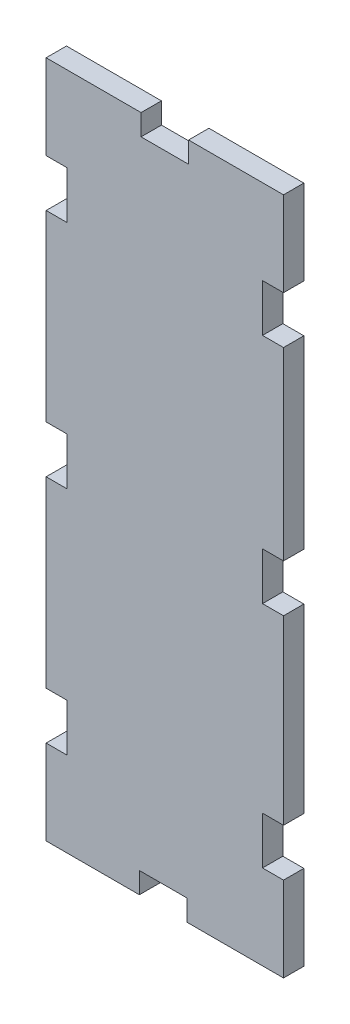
SolidWorks part; units mm, degrees
ref_plane "Front Plane" through (0, 0, 0) normal (0, 0, 1) x (1, 0, 0)
ref_plane "Top Plane" through (0, 0, 0) normal (0, 1, 0) x (1, 0, 0)
ref_plane "Right Plane" through (0, 0, 0) normal (1, 0, 0) x (0, 0, -1)
sketch "Sketch1" plane through (0, 0, 0) normal (0, 0, 1) x (1, 0, 0)
  line L1 (0, 0) -> (70, 0)
  line L2 (0, 0) -> (0, 200)
  line L3 (0, 200) -> (70, 200)
  line L4 (70, 0) -> (70, 200)
  dimension "D1" = 200
  dimension "D2" = 70
extrude "Boss-Extrude2" add sketch "Sketch1" along normal blind 6
sketch "Sketch4" plane through (0, 0, 6) normal (0, 0, 1) x (1, 0, 0)
  line L0 (0, 0) -> (70, 0) construction
  line L1 (70, 0) -> (70, 200) construction
  line L2 (70, 200) -> (0, 200) construction
  line L3 (0, 200) -> (0, 0) construction
  line B0 (28, 193.8) -> (42, 193.8)
  line B1 (42, 193.8) -> (42, 200)
  line B2 (42, 200) -> (28, 200)
  line B3 (28, 200) -> (28, 193.8)
  line B4 (27.5, 0) -> (41.5, 0)
  line B5 (41.5, 0) -> (41.5, 6.2)
  line B6 (41.5, 6.2) -> (27.5, 6.2)
  line B7 (27.5, 6.2) -> (27.5, 0)
  line B8 (6.2, 161) -> (6.2, 175)
  line B9 (6.2, 175) -> (0, 175)
  line B10 (0, 175) -> (0, 161)
  line B11 (0, 161) -> (6.2, 161)
  line B12 (0, 168) -> (6.2, 168) construction
  line B13 (6.2, 93) -> (6.2, 107)
  line B14 (6.2, 107) -> (0, 107)
  line B15 (0, 107) -> (0, 93)
  line B16 (0, 93) -> (6.2, 93)
  line B17 (0, 100) -> (6.2, 100) construction
  line B18 (6.2, 25) -> (6.2, 39)
  line B19 (6.2, 39) -> (0, 39)
  line B20 (0, 39) -> (0, 25)
  line B21 (0, 25) -> (6.2, 25)
  line B22 (0, 32) -> (6.2, 32) construction
  line B23 (70, 161) -> (70, 175)
  line B24 (70, 175) -> (63.8, 175)
  line B25 (63.8, 175) -> (63.8, 161)
  line B26 (63.8, 161) -> (70, 161)
  line B27 (63.8, 168) -> (70, 168) construction
  line B28 (70, 92.5) -> (70, 106.5)
  line B29 (70, 106.5) -> (63.8, 106.5)
  line B30 (63.8, 106.5) -> (63.8, 92.5)
  line B31 (63.8, 92.5) -> (70, 92.5)
  line B32 (63.8, 99.5) -> (70, 99.5) construction
  line B33 (70, 25) -> (70, 39)
  line B34 (70, 39) -> (63.8, 39)
  line B35 (63.8, 39) -> (63.8, 25)
  line B36 (63.8, 25) -> (70, 25)
  line B37 (63.8, 32) -> (70, 32) construction
  dimension "D1" = 32
  dimension "D2" = 100
  dimension "D3" = 32
  dimension "D4" = 32
  dimension "D5" = 32
sketch_block_instance "Block-laser-cut-slot-15x6-1"
sketch_block "Block1" parameters "D1"=14, "D2"=6.2
sketch_block_instance "Block1-1"
sketch_block_instance "Block1-2"
sketch_block_instance "Block1-3"
sketch_block_instance "Block1-4"
sketch_block_instance "Block1-5"
sketch_block_instance "Block1-6"
sketch_block_instance "Block1-7"
extrude "Cut-Extrude1" cut sketch "Sketch4" against normal blind 6
